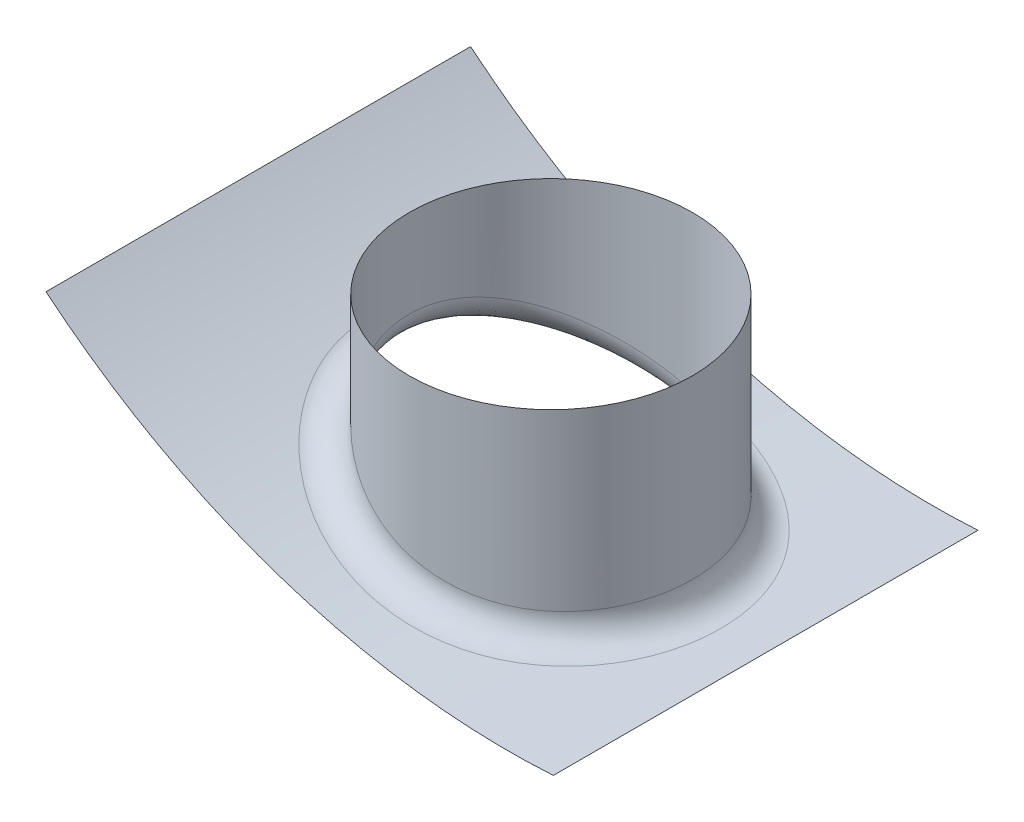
SolidWorks part; units mm, degrees
ref_plane "Front Plane" through (0, 0, 0) normal (0, 0, 1) x (1, 0, 0)
ref_plane "Top Plane" through (0, 0, 0) normal (0, 1, 0) x (1, 0, 0)
ref_plane "Right Plane" through (0, 0, 0) normal (1, 0, 0) x (0, 0, -1)
sketch "Sketch1" plane through (0, 0, 0) normal (0, 1, 0) x (1, 0, 0)
  circle A0 centre (0, 0) radius 25
  dimension "D1" = 50
surface "Surface-Extrude1" sketch "Sketch1" parameters "D1"=20, "D2"=35
sketch "Sketch2" plane through (0, 0, 0) normal (0, 0, 1) x (1, 0, 0)
  arc A0 (-51.6781, 13.274) -> (37.9404, -15.9033) centre (29.965, 111.8212) ccw
surface "Surface-Extrude2" sketch "Sketch2" parameters "D1"=75
fillet "Fillet1" radius 5 1 edges at (0, -35, 25)
